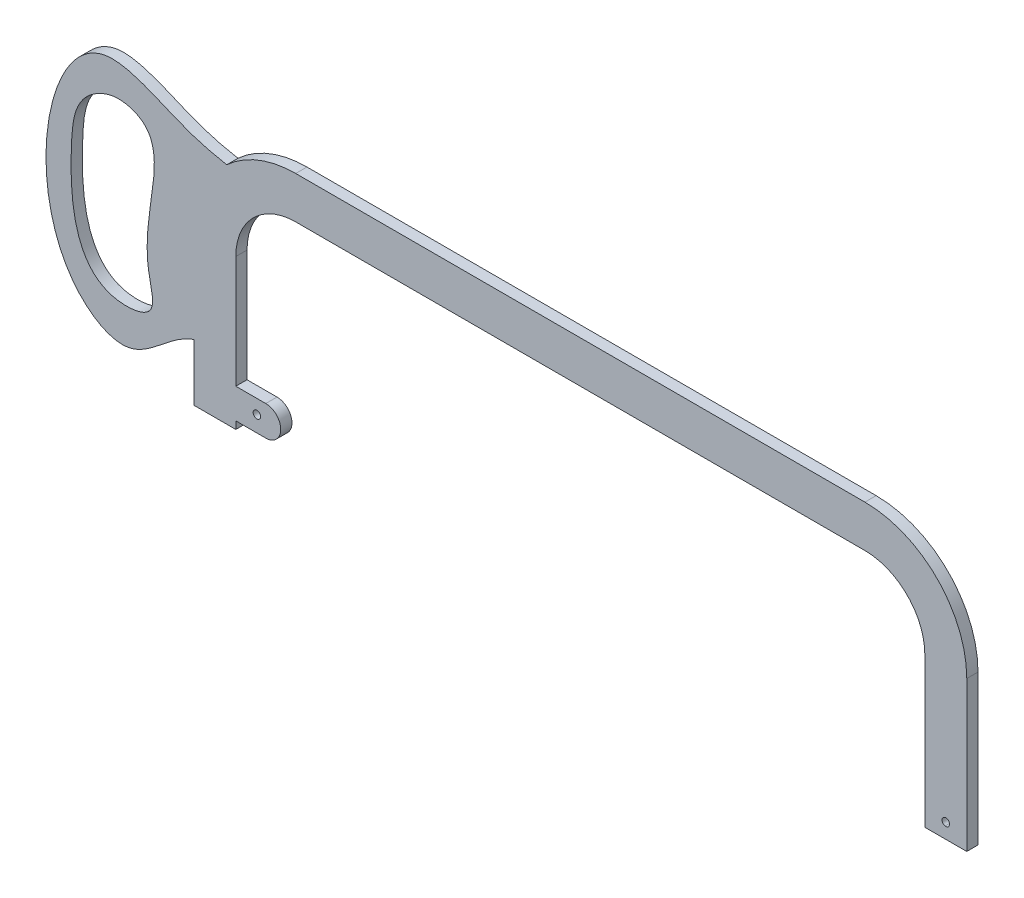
SolidWorks part; units mm, degrees
ref_plane "Front Plane" through (0, 0, 0) normal (0, 0, 1) x (1, 0, 0)
ref_plane "Top Plane" through (0, 0, 0) normal (0, 1, 0) x (1, 0, 0)
ref_plane "Right Plane" through (0, 0, 0) normal (1, 0, 0) x (0, 0, -1)
sketch "Sketch2" plane through (0, 0, 0) normal (0, 0, 1) x (1, 0, 0)
  line L0 (-176.2528, 0) -> (-176.2528, 63.5)
  line L1 (-150.8528, 88.9) -> (90.4472, 88.9)
  line L2 (115.8472, 63.5) -> (115.8472, 0)
  line L3 (115.8472, 0) -> (133.6272, 0)
  line L4 (133.6272, 0) -> (133.6272, 63.5)
  line L5 (90.4472, 106.68) -> (-150.8528, 106.68)
  line L6 (-194.0328, 63.5) -> (-194.0328, 0)
  line L7 (-194.0328, 0) -> (-176.2528, 0)
  arc A0 (-176.2528, 63.5) -> (-150.8528, 88.9) centre (-150.8528, 63.5) cw
  arc A1 (115.8472, 63.5) -> (90.4472, 88.9) centre (90.4472, 63.5) ccw
  arc A2 (-194.0328, 63.5) -> (-150.8528, 106.68) centre (-150.8528, 63.5) cw
  arc A3 (133.6272, 63.5) -> (90.4472, 106.68) centre (90.4472, 63.5) ccw
  dimension "D4" = 63.5
  dimension "D1" = 17.78
  dimension "D2" = 17.78
  dimension "D3" = 241.3
extrude "Extrude1" add sketch "Sketch2" along normal mid plane 4.7625
sketch "Sketch4" plane through (0, 0, 2.3813) normal (0, 0, 1) x (1, 0, 0)
  line L0 (-176.2528, 3.175) -> (-163.5528, 3.175)
  line L1 (-176.2528, 0) -> (-176.2528, 63.5) construction
  line L2 (-176.2528, 15.875) -> (-163.5528, 15.875)
  line L3 (-194.0328, 0) -> (-176.2528, 0) construction
  line L4 (-176.2528, 15.875) -> (-176.2528, 3.175)
  arc A0 (-163.5528, 3.175) -> (-163.5528, 15.875) centre (-163.5528, 9.525) ccw
  dimension "D1" = 12.7
  dimension "D2" = 3.175
  dimension "D3" = 12.7
extrude "Extrude2" add sketch "Sketch4" against normal up to surface (4.7625 mm away)
sketch "Sketch5" plane through (0, 0, 2.3813) normal (0, 0, 1) x (1, 0, 0)
  line L0 (133.6272, 0) -> (133.6272, 63.5) construction
  circle A0 centre (-167.3363, 9.9386) radius 1.5875
  circle A1 centre (124.7372, 6.35) radius 1.5875
  arc A2 (115.8472, 63.5) -> (90.4472, 88.9) centre (90.4472, 63.5) ccw construction
  point P4 (90.4472, 63.5)
  dimension "D1" = 3.175
  dimension "D2" = 57.15
  dimension "D3" = 8.89
extrude "Cut-Extrude1" cut sketch "Sketch5" against normal through all
sketch "Sketch6" plane through (0, 0, 2.3813) normal (0, 0, 1) x (1, 0, 0)
  line L1 (-163.5001, 92.9767) -> (-185.371, 71.1058)
  line L2 (-185.371, 71.1058) -> (-185.371, 24.5413)
  spline S0 degree 3 poles (-163.5001, 92.9767) (-174.2158, 94.2301) (-196.7764, 96.8689) (-252.8592, 130.1247) (-269.4265, 29.7933) (-217.0907, -1.2909) (-200.7578, 26.3378) (-186.8997, 24.7198) (-185.371, 24.5413) knots 0 0 0 0 0.145422 0.306167 0.711218 0.81884 0.980016 1 1 1 1
  spline S1 degree 3 poles (-229.0238, 98.1269) (-244.4394, 89.2831) (-247.2836, 60.1055) (-244.9157, 18.8537) (-208.0817, 23.1237) (-220.298, 55.3932) (-201.0956, 90.7405) (-229.0238, 98.1269) (-244.4394, 89.2831) (-247.2836, 60.1055) knots -0.440904 -0.140512 -0.093904 0 0.110818 0.392382 0.473965 0.559096 0.859488 0.906096 1 1.110818 1.392382 1.473965 only from (-241.012, 88.8095) to (-241.012, 88.8095)
  point P2 (-249.3752, 94.5849)
extrude "Extrude3" add sketch "Sketch6" against normal up to surface (4.7625 mm away)
ref_plane "Plane1" through (124.46, 0, 0) normal (1, 0, 0) x (0, 0, -1)
